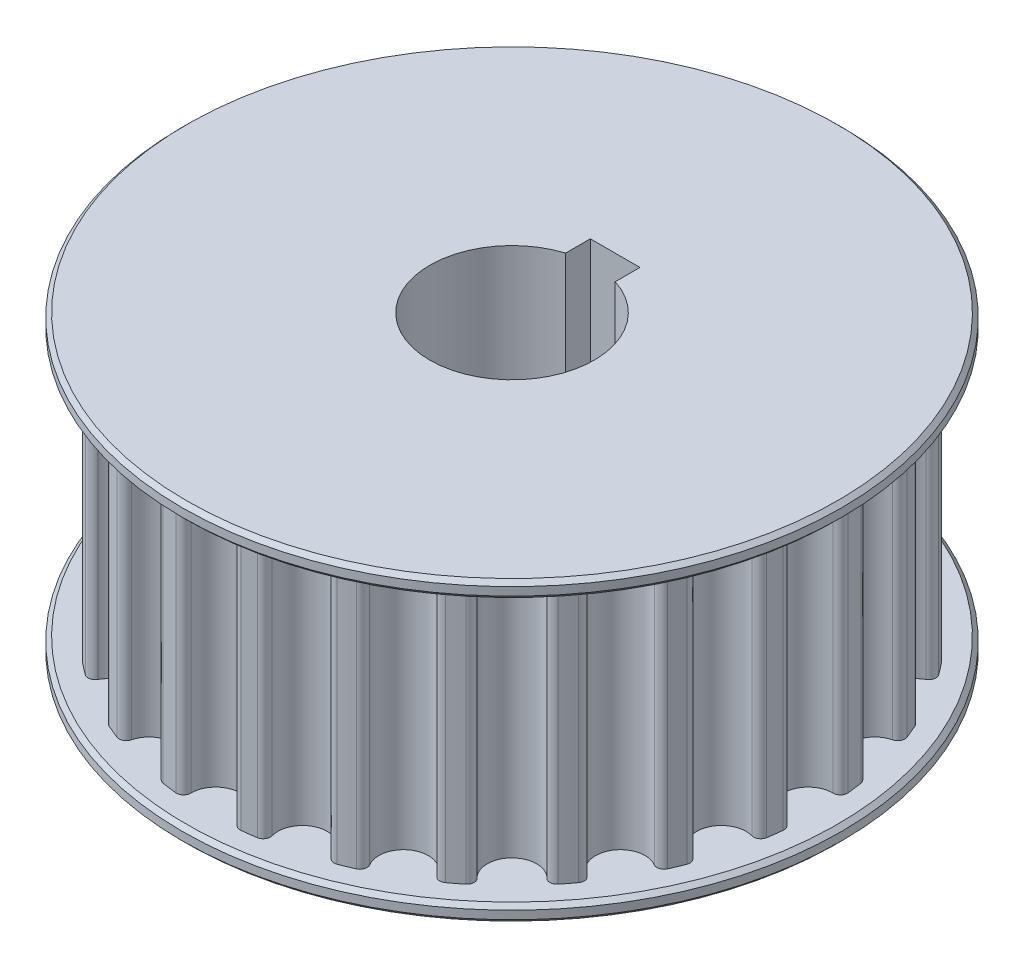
SolidWorks part; units mm, degrees
ref_plane "Front Plane" through (0, 0, 0) normal (0, 0, 1) x (1, 0, 0)
ref_plane "Top Plane" through (0, 0, 0) normal (0, 1, 0) x (1, 0, 0)
ref_plane "Right Plane" through (0, 0, 0) normal (1, 0, 0) x (0, 0, -1)
sketch "Sketch1" plane through (0, 0, 0) normal (0, 1, 0) x (1, 0, 0)
  line L1 (0, 0) -> (0, 17.965) construction
  line L2 (0, 0) -> (-4.6497, 17.3529) construction
  line L3 (-2.1491, 16.3241) -> (-2.418, 18.3665) construction
  line L4 (-2.1491, 16.3241) -> (0, 0) construction
  line L9 (-1.505, 6.2576) -> (1.505, 6.2576)
  line L10 (-1.505, 6.2576) -> (-1.505, 4.7576)
  line L11 (-2.418, 18.3665) -> (-2.4931, 18.9366) construction
  line L12 (-1.505, 4.7576) -> (1.505, 4.7576)
  line L13 (1.505, 6.2576) -> (1.505, 4.7576)
  circle A0 centre (0, 0) radius 4.99
  circle A1 centre (0, 0) radius 16.465 construction
  circle A2 centre (0, 0) radius 17.965 construction
  arc A4 (-4.2615, 15.904) -> (-3.2063, 17.7612) centre (-4.6497, 17.3529) ccw
  arc A5 (-1.4999, 17.9858) -> (0, 16.465) centre (0, 17.965) ccw
  circle A6 centre (0, 0) radius 18.095 construction
  arc A7 (-3.2063, 17.7612) -> (-2.8589, 18.3031) centre (-2.7926, 17.8782) cw
  arc A8 (-1.9757, 18.4193) -> (-1.4999, 17.9858) centre (-1.9298, 17.9918) cw
  arc A9 (-2.8589, 18.3031) -> (-1.9757, 18.4193) centre (0, 0) cw
  circle A10 centre (0, 0) radius 19.1 construction
  arc A86 (0, 16.465) -> (1.4999, 17.9858) centre (0, 17.965) ccw
  arc A87 (1.4999, 17.9858) -> (1.9757, 18.4193) centre (1.9298, 17.9918) cw
  arc A88 (1.9757, 18.4193) -> (2.8589, 18.3031) centre (0, 0) cw
  arc A89 (2.8589, 18.3031) -> (3.2063, 17.7612) centre (2.7926, 17.8782) cw
  arc A90 (3.2063, 17.7612) -> (4.2615, 15.904) centre (4.6497, 17.3529) ccw
  arc A91 (4.2615, 15.904) -> (6.1038, 16.9848) centre (4.6497, 17.3529) ccw
  arc A92 (6.1038, 16.9848) -> (6.6756, 17.2804) centre (6.5207, 16.8793) cw
  arc A93 (6.6756, 17.2804) -> (7.4987, 16.9395) centre (0, 0) cw
  arc A94 (7.4987, 16.9395) -> (7.694, 16.3261) centre (7.3246, 16.5463) cw
  arc A95 (7.694, 16.3261) -> (8.2325, 14.2591) centre (8.9825, 15.5581) ccw
  arc A96 (8.2325, 14.2591) -> (10.2918, 14.8263) centre (8.9825, 15.5581) ccw
  arc A97 (10.2918, 14.8263) -> (10.9207, 14.9638) centre (10.6672, 14.6164) cw
  arc A98 (10.9207, 14.9638) -> (11.6274, 14.4215) centre (0, 0) cw
  arc A99 (11.6274, 14.4215) -> (11.6573, 13.7785) centre (11.3575, 14.0867) cw
  arc A100 (11.6573, 13.7785) -> (11.6425, 11.6425) centre (12.7032, 12.7032) ccw
  arc A101 (11.6425, 11.6425) -> (13.7785, 11.6573) centre (12.7032, 12.7032) ccw
  arc A102 (13.7785, 11.6573) -> (14.4215, 11.6274) centre (14.0867, 11.3575) cw
  arc A103 (14.4215, 11.6274) -> (14.9638, 10.9207) centre (0, 0) cw
  arc A104 (14.9638, 10.9207) -> (14.8263, 10.2918) centre (14.6164, 10.6672) cw
  arc A105 (14.8263, 10.2918) -> (14.2591, 8.2325) centre (15.5581, 8.9825) ccw
  arc A106 (14.2591, 8.2325) -> (16.3261, 7.694) centre (15.5581, 8.9825) ccw
  arc A107 (16.3261, 7.694) -> (16.9395, 7.4987) centre (16.5463, 7.3246) cw
  arc A108 (16.9395, 7.4987) -> (17.2804, 6.6756) centre (0, 0) cw
  arc A109 (17.2804, 6.6756) -> (16.9848, 6.1038) centre (16.8793, 6.5207) cw
  arc A110 (16.9848, 6.1038) -> (15.904, 4.2615) centre (17.3529, 4.6497) ccw
  arc A111 (15.904, 4.2615) -> (17.7612, 3.2063) centre (17.3529, 4.6497) ccw
  arc A112 (17.7612, 3.2063) -> (18.3031, 2.8589) centre (17.8782, 2.7926) cw
  arc A113 (18.3031, 2.8589) -> (18.4193, 1.9757) centre (0, 0) cw
  arc A114 (18.4193, 1.9757) -> (17.9858, 1.4999) centre (17.9918, 1.9298) cw
  arc A115 (17.9858, 1.4999) -> (16.465, 0) centre (17.965, 0) ccw
  arc A116 (16.465, 0) -> (17.9858, -1.4999) centre (17.965, 0) ccw
  arc A117 (17.9858, -1.4999) -> (18.4193, -1.9757) centre (17.9918, -1.9298) cw
  arc A118 (18.4193, -1.9757) -> (18.3031, -2.8589) centre (0, 0) cw
  arc A119 (18.3031, -2.8589) -> (17.7612, -3.2063) centre (17.8782, -2.7926) cw
  arc A120 (17.7612, -3.2063) -> (15.904, -4.2615) centre (17.3529, -4.6497) ccw
  arc A121 (15.904, -4.2615) -> (16.9848, -6.1038) centre (17.3529, -4.6497) ccw
  arc A122 (16.9848, -6.1038) -> (17.2804, -6.6756) centre (16.8793, -6.5207) cw
  arc A123 (17.2804, -6.6756) -> (16.9395, -7.4987) centre (0, 0) cw
  arc A124 (16.9395, -7.4987) -> (16.3261, -7.694) centre (16.5463, -7.3246) cw
  arc A125 (16.3261, -7.694) -> (14.2591, -8.2325) centre (15.5581, -8.9825) ccw
  arc A126 (14.2591, -8.2325) -> (14.8263, -10.2918) centre (15.5581, -8.9825) ccw
  arc A127 (14.8263, -10.2918) -> (14.9638, -10.9207) centre (14.6164, -10.6672) cw
  arc A128 (14.9638, -10.9207) -> (14.4215, -11.6274) centre (0, 0) cw
  arc A129 (14.4215, -11.6274) -> (13.7785, -11.6573) centre (14.0867, -11.3575) cw
  arc A130 (13.7785, -11.6573) -> (11.6425, -11.6425) centre (12.7032, -12.7032) ccw
  arc A131 (11.6425, -11.6425) -> (11.6573, -13.7785) centre (12.7032, -12.7032) ccw
  arc A132 (11.6573, -13.7785) -> (11.6274, -14.4215) centre (11.3575, -14.0867) cw
  arc A133 (11.6274, -14.4215) -> (10.9207, -14.9638) centre (0, 0) cw
  arc A134 (10.9207, -14.9638) -> (10.2918, -14.8263) centre (10.6672, -14.6164) cw
  arc A135 (10.2918, -14.8263) -> (8.2325, -14.2591) centre (8.9825, -15.5581) ccw
  arc A136 (8.2325, -14.2591) -> (7.694, -16.3261) centre (8.9825, -15.5581) ccw
  arc A137 (7.694, -16.3261) -> (7.4987, -16.9395) centre (7.3246, -16.5463) cw
  arc A138 (7.4987, -16.9395) -> (6.6756, -17.2804) centre (0, 0) cw
  arc A139 (6.6756, -17.2804) -> (6.1038, -16.9848) centre (6.5207, -16.8793) cw
  arc A140 (6.1038, -16.9848) -> (4.2615, -15.904) centre (4.6497, -17.3529) ccw
  arc A141 (4.2615, -15.904) -> (3.2063, -17.7612) centre (4.6497, -17.3529) ccw
  arc A142 (3.2063, -17.7612) -> (2.8589, -18.3031) centre (2.7926, -17.8782) cw
  arc A143 (2.8589, -18.3031) -> (1.9757, -18.4193) centre (0, 0) cw
  arc A144 (1.9757, -18.4193) -> (1.4999, -17.9858) centre (1.9298, -17.9918) cw
  arc A145 (1.4999, -17.9858) -> (0, -16.465) centre (0, -17.965) ccw
  arc A146 (0, -16.465) -> (-1.4999, -17.9858) centre (0, -17.965) ccw
  arc A147 (-1.4999, -17.9858) -> (-1.9757, -18.4193) centre (-1.9298, -17.9918) cw
  arc A148 (-1.9757, -18.4193) -> (-2.8589, -18.3031) centre (0, 0) cw
  arc A149 (-2.8589, -18.3031) -> (-3.2063, -17.7612) centre (-2.7926, -17.8782) cw
  arc A150 (-3.2063, -17.7612) -> (-4.2615, -15.904) centre (-4.6497, -17.3529) ccw
  arc A151 (-4.2615, -15.904) -> (-6.1038, -16.9848) centre (-4.6497, -17.3529) ccw
  arc A152 (-6.1038, -16.9848) -> (-6.6756, -17.2804) centre (-6.5207, -16.8793) cw
  arc A153 (-6.6756, -17.2804) -> (-7.4987, -16.9395) centre (0, 0) cw
  arc A154 (-7.4987, -16.9395) -> (-7.694, -16.3261) centre (-7.3246, -16.5463) cw
  arc A155 (-7.694, -16.3261) -> (-8.2325, -14.2591) centre (-8.9825, -15.5581) ccw
  arc A156 (-8.2325, -14.2591) -> (-10.2918, -14.8263) centre (-8.9825, -15.5581) ccw
  arc A157 (-10.2918, -14.8263) -> (-10.9207, -14.9638) centre (-10.6672, -14.6164) cw
  arc A158 (-10.9207, -14.9638) -> (-11.6274, -14.4215) centre (0, 0) cw
  arc A159 (-11.6274, -14.4215) -> (-11.6573, -13.7785) centre (-11.3575, -14.0867) cw
  arc A160 (-11.6573, -13.7785) -> (-11.6425, -11.6425) centre (-12.7032, -12.7032) ccw
  arc A161 (-11.6425, -11.6425) -> (-13.7785, -11.6573) centre (-12.7032, -12.7032) ccw
  arc A162 (-13.7785, -11.6573) -> (-14.4215, -11.6274) centre (-14.0867, -11.3575) cw
  arc A163 (-14.4215, -11.6274) -> (-14.9638, -10.9207) centre (0, 0) cw
  arc A164 (-14.9638, -10.9207) -> (-14.8263, -10.2918) centre (-14.6164, -10.6672) cw
  arc A165 (-14.8263, -10.2918) -> (-14.2591, -8.2325) centre (-15.5581, -8.9825) ccw
  arc A166 (-14.2591, -8.2325) -> (-16.3261, -7.694) centre (-15.5581, -8.9825) ccw
  arc A167 (-16.3261, -7.694) -> (-16.9395, -7.4987) centre (-16.5463, -7.3246) cw
  arc A168 (-16.9395, -7.4987) -> (-17.2804, -6.6756) centre (0, 0) cw
  arc A169 (-17.2804, -6.6756) -> (-16.9848, -6.1038) centre (-16.8793, -6.5207) cw
  arc A170 (-16.9848, -6.1038) -> (-15.904, -4.2615) centre (-17.3529, -4.6497) ccw
  arc A171 (-15.904, -4.2615) -> (-17.7612, -3.2063) centre (-17.3529, -4.6497) ccw
  arc A172 (-17.7612, -3.2063) -> (-18.3031, -2.8589) centre (-17.8782, -2.7926) cw
  arc A173 (-18.3031, -2.8589) -> (-18.4193, -1.9757) centre (0, 0) cw
  arc A174 (-18.4193, -1.9757) -> (-17.9858, -1.4999) centre (-17.9918, -1.9298) cw
  arc A175 (-17.9858, -1.4999) -> (-16.465, 0) centre (-17.965, 0) ccw
  arc A176 (-16.465, 0) -> (-17.9858, 1.4999) centre (-17.965, 0) ccw
  arc A177 (-17.9858, 1.4999) -> (-18.4193, 1.9757) centre (-17.9918, 1.9298) cw
  arc A178 (-18.4193, 1.9757) -> (-18.3031, 2.8589) centre (0, 0) cw
  arc A179 (-18.3031, 2.8589) -> (-17.7612, 3.2063) centre (-17.8782, 2.7926) cw
  arc A180 (-17.7612, 3.2063) -> (-15.904, 4.2615) centre (-17.3529, 4.6497) ccw
  arc A181 (-15.904, 4.2615) -> (-16.9848, 6.1038) centre (-17.3529, 4.6497) ccw
  arc A182 (-16.9848, 6.1038) -> (-17.2804, 6.6756) centre (-16.8793, 6.5207) cw
  arc A183 (-17.2804, 6.6756) -> (-16.9395, 7.4987) centre (0, 0) cw
  arc A184 (-16.9395, 7.4987) -> (-16.3261, 7.694) centre (-16.5463, 7.3246) cw
  arc A185 (-16.3261, 7.694) -> (-14.2591, 8.2325) centre (-15.5581, 8.9825) ccw
  arc A186 (-14.2591, 8.2325) -> (-14.8263, 10.2918) centre (-15.5581, 8.9825) ccw
  arc A187 (-14.8263, 10.2918) -> (-14.9638, 10.9207) centre (-14.6164, 10.6672) cw
  arc A188 (-14.9638, 10.9207) -> (-14.4215, 11.6274) centre (0, 0) cw
  arc A189 (-14.4215, 11.6274) -> (-13.7785, 11.6573) centre (-14.0867, 11.3575) cw
  arc A190 (-13.7785, 11.6573) -> (-11.6425, 11.6425) centre (-12.7032, 12.7032) ccw
  arc A191 (-11.6425, 11.6425) -> (-11.6573, 13.7785) centre (-12.7032, 12.7032) ccw
  arc A192 (-11.6573, 13.7785) -> (-11.6274, 14.4215) centre (-11.3575, 14.0867) cw
  arc A193 (-11.6274, 14.4215) -> (-10.9207, 14.9638) centre (0, 0) cw
  arc A194 (-10.9207, 14.9638) -> (-10.2918, 14.8263) centre (-10.6672, 14.6164) cw
  arc A195 (-10.2918, 14.8263) -> (-8.2325, 14.2591) centre (-8.9825, 15.5581) ccw
  arc A196 (-8.2325, 14.2591) -> (-7.694, 16.3261) centre (-8.9825, 15.5581) ccw
  arc A197 (-7.694, 16.3261) -> (-7.4987, 16.9395) centre (-7.3246, 16.5463) cw
  arc A198 (-7.4987, 16.9395) -> (-6.6756, 17.2804) centre (0, 0) cw
  arc A199 (-6.6756, 17.2804) -> (-6.1038, 16.9848) centre (-6.5207, 16.8793) cw
  arc A200 (-6.1038, 16.9848) -> (-4.2615, 15.904) centre (-4.6497, 17.3529) ccw
  point P22 (0, 6.2576)
  point P255 (0, 0)
  dimension "D2" = 9.98
  dimension "D4" = 1.5
  dimension "D5" = 0.43
  dimension "D7" = 2.06
  dimension "D9" = 1.5
  dimension "D8" = 3.01
  dimension "D3" = 15
  dimension "D6" = 0.8909
  dimension "D10" = 24
  dimension "D11" = 0.575
extrude "Boss-Extrude1" add sketch "Sketch1" along normal mid plane 16
sketch "Sketch2" plane through (0, 8, 0) normal (0, 1, 0) x (1, 0, 0)
  line L8 (1.505, 6.2576) -> (1.505, 4.7576) construction
  line L9 (-1.505, 6.2576) -> (1.505, 6.2576) construction
  line L10 (-1.505, 6.2576) -> (-1.505, 4.7576) construction
  line L11 (1.505, 6.2576) -> (1.505, 4.7576)
  line L12 (-1.505, 6.2576) -> (1.505, 6.2576)
  line L13 (-1.505, 6.2576) -> (-1.505, 4.7576)
  circle A0 centre (0, 0) radius 20
  arc A5 (-1.505, 4.7576) -> (1.505, 4.7576) centre (0, 0) ccw construction
  arc A6 (-1.505, 4.7576) -> (1.505, 4.7576) centre (0, 0) ccw
  dimension "D1" = 40
extrude "Boss-Extrude2" add sketch "Sketch2" along normal blind 1
chamfer "Chamfer1" distance 0.25 angle 45 2 edges at (0, 8, 20) (0, 9, 20)
mirror "Mirror1" about plane through (0, 0, 0) normal (0, 1, 0) of "Chamfer1", "Boss-Extrude2"
sketch "Sketch3" plane through (0, 0, 0) normal (0, 0, 1) x (1, 0, 0)
  circle A0 centre (0, 0) radius 1.2
  dimension "D1" = 2.4
extrude "Cut-Extrude1" cut sketch "Sketch3" against normal through all
